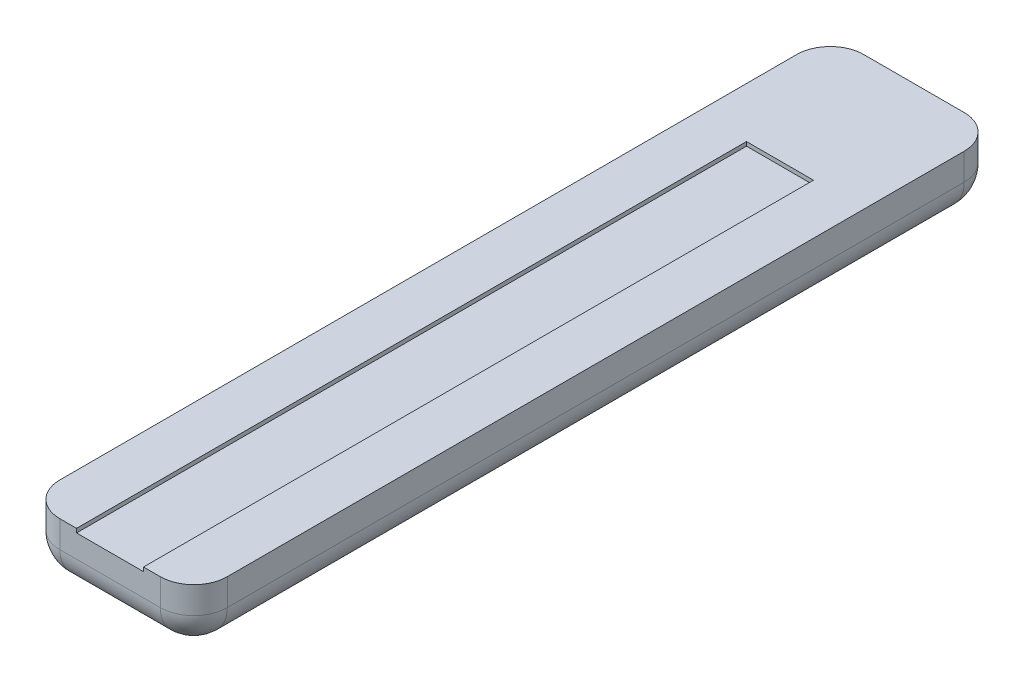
SolidWorks part; units mm, degrees
ref_plane "Front Plane" through (0, 0, 0) normal (0, 0, 1) x (1, 0, 0)
ref_plane "Top Plane" through (0, 0, 0) normal (0, 1, 0) x (1, 0, 0)
ref_plane "Right Plane" through (0, 0, 0) normal (1, 0, 0) x (0, 0, -1)
sketch "Sketch1" plane through (0, 0, 0) normal (0, 1, 0) x (1, 0, 0)
  line L1 (-15.875, 0) -> (15.875, 0)
  line L2 (-15.875, 0) -> (-15.875, 152.4)
  line L3 (-15.875, 152.4) -> (15.875, 152.4)
  line L4 (15.875, 0) -> (15.875, 152.4)
  dimension "D1" = 152.4
  dimension "D2" = 31.75
extrude "Extrude1" add sketch "Sketch1" against normal blind 11.43
fillet "Fillet1" radius 6.35 4 edges at (15.875, -5.715, -152.4) (-15.875, -5.715, -152.4) (-15.875, -5.715, 0) (15.875, -5.715, 0)
fillet "Fillet2" radius 6.35 8 edges at (-14.0151, -11.43, -1.8599) (-15.875, -11.43, -76.2) (-14.0151, -11.43, -150.5401) (0, -11.43, -152.4) (14.0151, -11.43, -150.5401) (15.875, -11.43, -76.2) (14.0151, -11.43, -1.8599) (0, -11.43, 0)
sketch "Sketch2" plane through (0, 0, 0) normal (0, 1, 0) x (1, 0, 0)
  line L0 (-9.525, 0) -> (9.525, 0) construction
  line L1 (-6.35, 0) -> (6.35, 0)
  line L2 (-6.35, 0) -> (-6.35, 127)
  line L3 (-6.35, 127) -> (6.35, 127)
  line L4 (6.35, 0) -> (6.35, 127)
  line L5 (0, 152.4) -> (0, -33.4902) construction
  line L6 (9.525, 152.4) -> (-9.525, 152.4) construction
  dimension "D1" = 12.7
  dimension "D2" = 127
extrude "Cut-Extrude1" cut sketch "Sketch2" against normal blind 0.762
